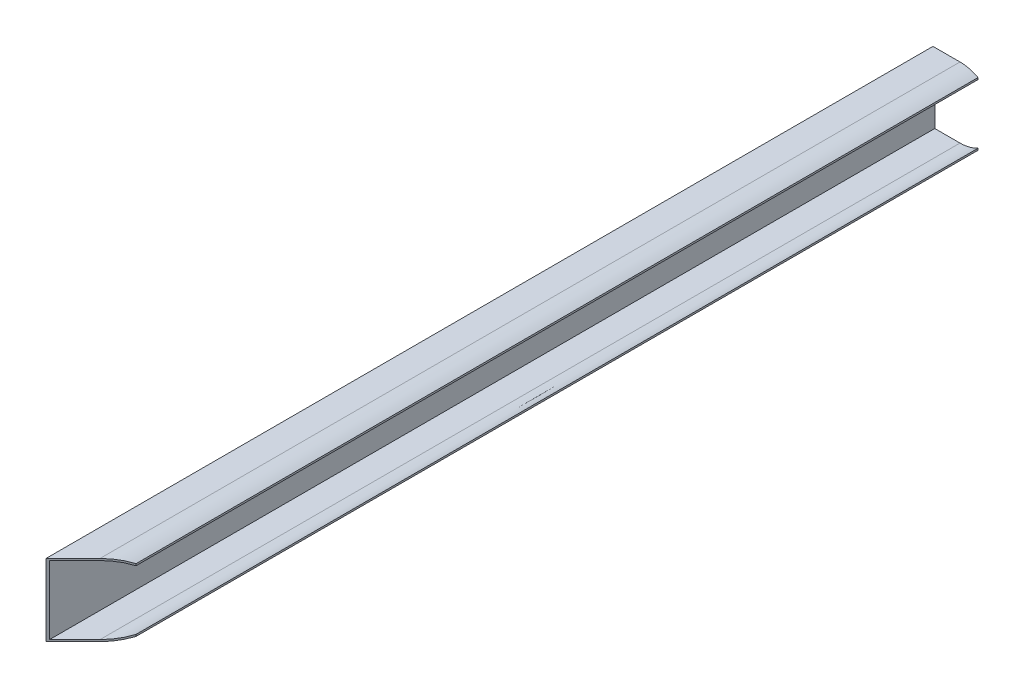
SolidWorks part; units mm, degrees
ref_plane "Plan de face" through (0, 0, 0) normal (0, 0, 1) x (1, 0, 0)
ref_plane "Plan de dessus" through (0, 0, 0) normal (0, 1, 0) x (1, 0, 0)
ref_plane "Plan de droite" through (0, 0, 0) normal (1, 0, 0) x (0, 0, -1)
sketch "Esquisse1" plane through (0, 0, 0) normal (0, 0, 1) x (1, 0, 0)
  line L0 (0, 0) -> (0, 80)
  line L1 (0, 80) -> (30, 80)
  line L2 (0, 40) -> (81.0721, 40) construction
  line L3 (2, 78) -> (2, 2)
  line L4 (0, 0) -> (30, 0)
  line L5 (2, 78) -> (30, 78)
  line L6 (50, 75) -> (50, 73)
  line L7 (50, 5) -> (50, 7)
  line L8 (2, 2) -> (30, 2)
  spline S0 degree 2 poles (30, 80) (40.6033, 79.9515) (50, 75) knots 0 0 0 1 1 1
  spline S1 degree 2 poles (30, 0) (40.6033, 0.0485) (50, 5) knots 0 0 0 1 1 1
  spline S2 degree 2 poles (30, 78) (40.6033, 77.9515) (50, 73) knots 0 0 0 1 1 1
  spline S3 degree 2 poles (30, 2) (40.6033, 2.0485) (50, 7) knots 0 0 0 1 1 1
  point P20 (2, 40)
  dimension "D1" = 80
  dimension "D2" = 30
  dimension "D3" = 5
  dimension "D4" = 50
  dimension "D5" = 1.2
  dimension "D6" = 10
  dimension "D7" = 5
  dimension "D8" = 10
  dimension "D9" = 1.2
  dimension "D10" = 28
  dimension "D11" = 20
  dimension "D12" = 2
  dimension "D13" = 2
extrude "Extrusion1" add sketch "Esquisse1" along normal blind 985
sketch "Esquisse2" plane through (0, 80, 0) normal (0, 1, 0) x (-1, 0, 0)
  line L0 (0, 985) -> (-50, 935)
  line L2 (-50, 985) -> (-50, 0) construction
  line L3 (-50, 935) -> (-50, 985)
  line L4 (0, 985) -> (-50, 985)
  dimension "D1" = 45
extrude "Extrusion3" cut sketch "Esquisse2" against normal up to next
